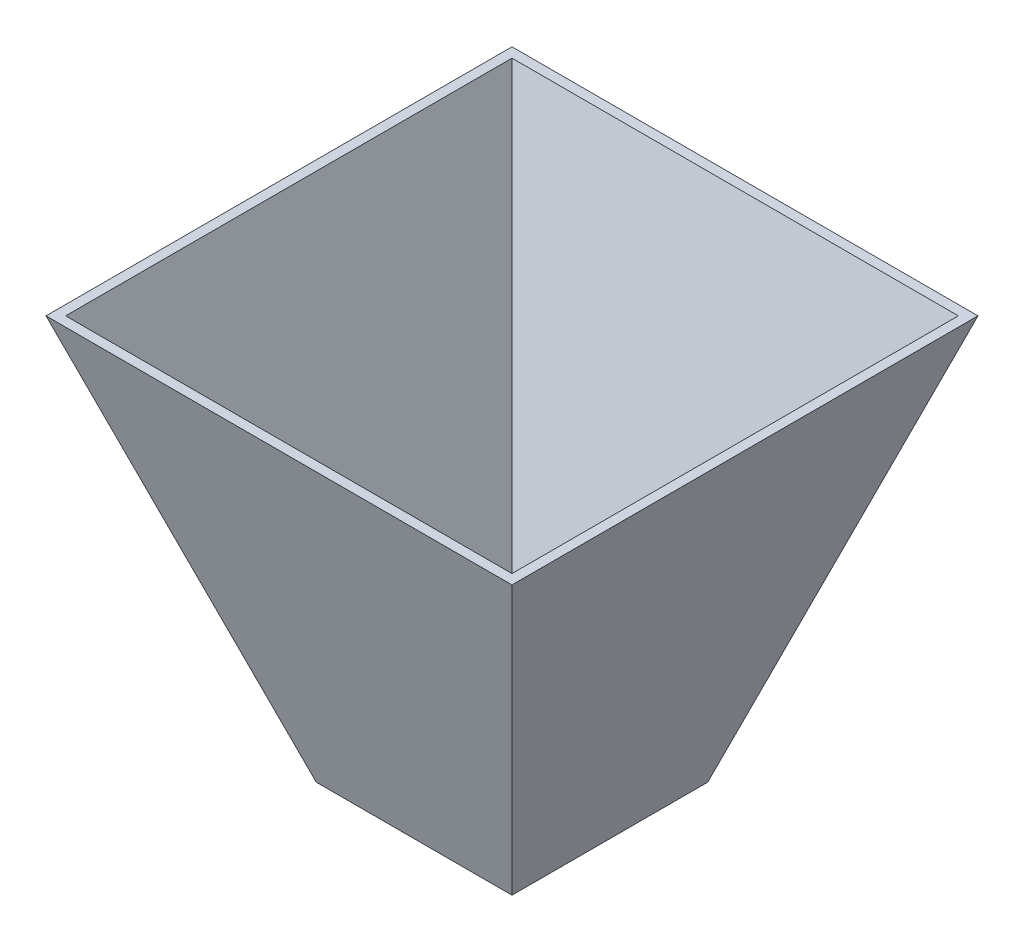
SolidWorks part; units mm, degrees
ref_plane "Front Plane" through (0, 0, 0) normal (0, 0, 1) x (1, 0, 0)
ref_plane "Top Plane" through (0, 0, 0) normal (0, 1, 0) x (1, 0, 0)
ref_plane "Right Plane" through (0, 0, 0) normal (1, 0, 0) x (0, 0, -1)
sketch "Sketch1" plane through (0, 0, 0) normal (0, 1, 0) x (1, 0, 0)
  line L1 (-31.5, 31.5) -> (31.5, 31.5)
  line L2 (-31.5, 31.5) -> (-31.5, -31.5)
  line L3 (-31.5, -31.5) -> (31.5, -31.5)
  line L4 (31.5, 31.5) -> (31.5, -31.5)
  line L5 (-31.5, 31.5) -> (31.5, -31.5) construction
  line L6 (-31.5, -31.5) -> (31.5, 31.5) construction
  point P0 (0, 0)
ref_plane "Plane1" through (0, 130, 0) normal (0, 1, 0) x (1, 0, 0)
sketch "Sketch2" plane through (0, 130, 0) normal (0, 1, 0) x (1, 0, 0)
  line L1 (75, -75) -> (-75, -75)
  line L2 (75, -75) -> (75, 75)
  line L3 (75, 75) -> (-75, 75)
  line L4 (-75, -75) -> (-75, 75)
  line L5 (75, -75) -> (-75, 75) construction
  line L6 (75, 75) -> (-75, -75) construction
  point P0 (0, 0)
loft "Loft1" add profiles "Sketch2", "Sketch1"
sketch "Sketch3" plane through (0, 0, 0) normal (0, -1, 0) x (1, 0, 0)
  circle A0 centre (0, 0) radius 31.5
extrude "Boss-Extrude1" add sketch "Sketch3" along normal blind 0.02 contours A0
shell "Shell2" thickness 3
equation "\"D2@Sketch1\"=\"D1@Sketch1\""
equation "\"D2@Sketch2\"=\"D1@Sketch2\""
